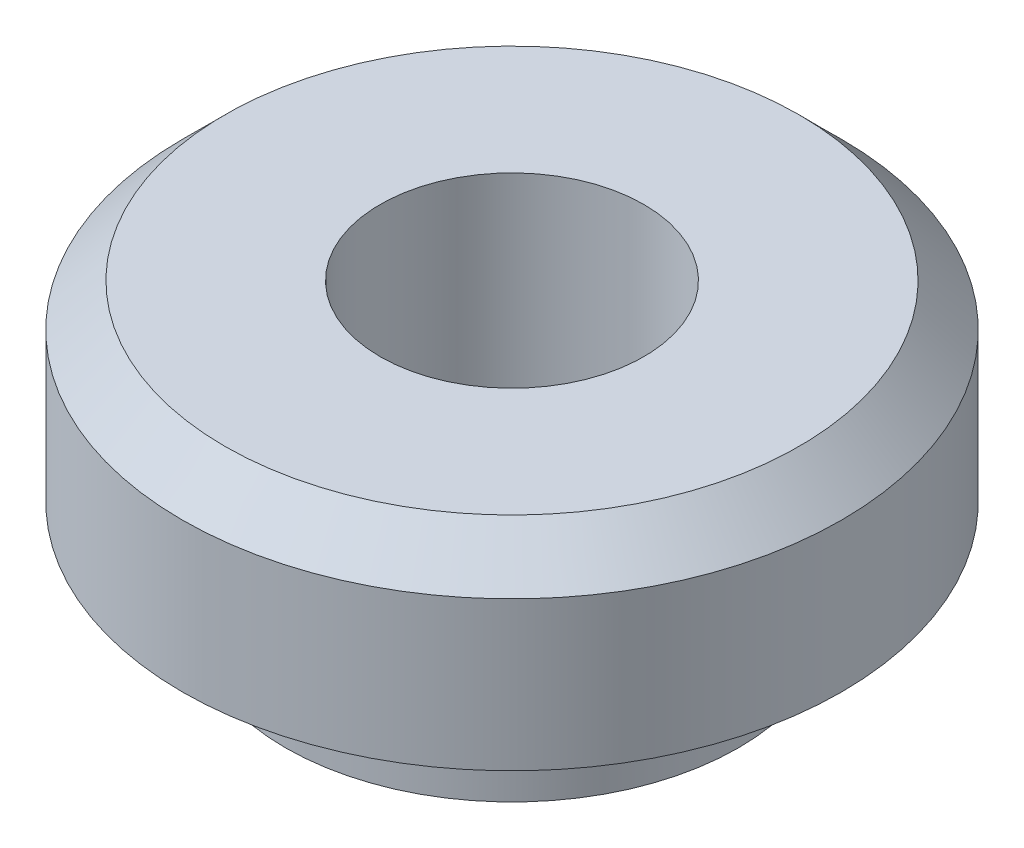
SolidWorks part; units mm, degrees
ref_plane "Front" through (0, 0, 0) normal (0, 0, 1) x (1, 0, 0)
ref_plane "Top" through (0, 0, 0) normal (0, 1, 0) x (1, 0, 0)
ref_plane "Side" through (0, 0, 0) normal (1, 0, 0) x (0, 0, -1)
sketch "Sketch1" plane through (0, 0, 0) normal (1, 0, 0) x (0, 0, -1)
  line L0 (-1.5748, -1.1938) -> (-1.5748, 2.286)
  line L1 (-1.5748, 2.286) -> (-3.429, 2.286)
  line L2 (-3.429, 2.286) -> (-3.937, 1.778)
  line L3 (-3.937, 1.778) -> (-3.937, 0)
  line L4 (-3.937, 0) -> (-2.7051, 0)
  line L5 (-2.7051, 0) -> (-2.7051, -1.1938)
  line L6 (-2.7051, -1.1938) -> (-1.5748, -1.1938)
  line L7 (0, 2.54) -> (0, -2.54) construction
  dimension "D1" = 1.5748
  dimension "D2" = 2.7051
  dimension "D3" = 0.508
  dimension "D4" = 0.508
  dimension "D5" = 3.937
  dimension "D6" = 2.286
  dimension "D7" = 1.1938
revolve "Base-Revolve" add sketch "Sketch1" angle 360 about L7
